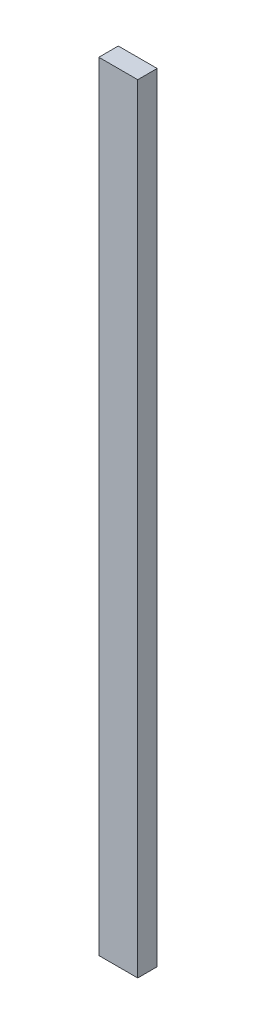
SolidWorks part; units mm, degrees
ref_plane "Front Plane" through (0, 0, 0) normal (0, 0, 1) x (1, 0, 0)
ref_plane "Top Plane" through (0, 0, 0) normal (0, 1, 0) x (1, 0, 0)
ref_plane "Right Plane" through (0, 0, 0) normal (1, 0, 0) x (0, 0, -1)
sketch "Sketch1" plane through (0, 0, 0) normal (0, 0, 1) x (1, 0, 0)
  line L1 (-39.424, 32.5008) -> (-33.074, 32.5008)
  line L2 (-39.424, 32.5008) -> (-39.424, -94.4992)
  line L3 (-39.424, -94.4992) -> (-33.074, -94.4992)
  line L4 (-33.074, 32.5008) -> (-33.074, -94.4992)
  dimension "D1" = 6.35
  dimension "D2" = 127
extrude "Boss-Extrude1" add sketch "Sketch1" along normal blind 3.175
